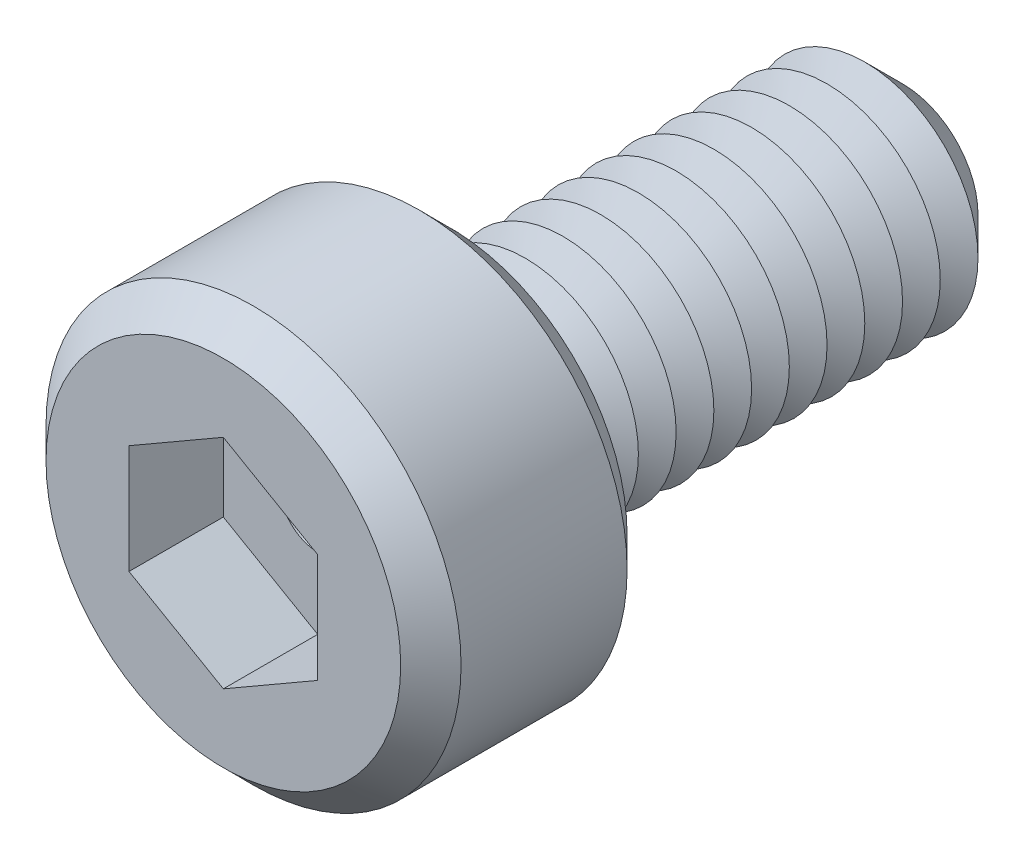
SolidWorks part; units mm, degrees
ref_plane "Front Plane" through (0, 0, 0) normal (0, 0, 1) x (1, 0, 0)
ref_plane "Top Plane" through (0, 0, 0) normal (0, 1, 0) x (1, 0, 0)
ref_plane "Right Plane" through (0, 0, 0) normal (1, 0, 0) x (0, 0, -1)
sketch "Sketch1" plane through (0, 0, 0) normal (0, 0, 1) x (1, 0, 0)
  circle A0 centre (0, 0) radius 2.75
  dimension "D1" = 5.5
extrude "Boss-Extrude1" add sketch "Sketch1" along normal blind 3
sketch "Sketch2" plane through (0, 0, 0) normal (0, 0, -1) x (-1, 0, 0)
  circle A0 centre (0, 0) radius 1.5
  dimension "D1" = 3
extrude "Boss-Extrude2" add sketch "Sketch2" along normal blind 6
chamfer "Chamfer1" distance 0.5 angle 45 1 edges at (-1.5, 0, -6)
sketch "Sketch3" plane through (0, 0, 0) normal (1, 0, 0) x (0, 0, -1)
  line L0 (-2.5121, 0) -> (4.5776, 0) construction
sketch "Sketch4" plane through (0, 0, 0) normal (1, 0, 0) x (0, 0, -1)
  line L0 (0, 1.5) -> (0.25, 1.067)
  line L1 (0.25, 1.067) -> (0.5, 1.5)
  line L2 (5.5, 1.5) -> (0, 1.5) construction
  line L3 (0.5, 1.5) -> (0, 1.5)
  dimension "D1" = 0.5
revolve "Cut-Revolve1" cut sketch "Sketch4" angle 360 about L0
pattern_linear "LPattern1" count 11 spacing 0.5 along (0, 0, -1) of "Cut-Revolve1"
sketch "Sketch5" plane through (0, 0, 3) normal (0, 0, 1) x (1, 0, 0)
  line L1 (0, 1.4434) -> (-1.25, 0.7217)
  line L2 (-1.25, 0.7217) -> (-1.25, -0.7217)
  line L3 (-1.25, -0.7217) -> (0, -1.4434)
  line L4 (0, -1.4434) -> (1.25, -0.7217)
  line L5 (1.25, -0.7217) -> (1.25, 0.7217)
  line L6 (1.25, 0.7217) -> (0, 1.4434)
  circle A0 centre (0, 0) radius 1.25 construction
  dimension "D1" = 2.5
extrude "Cut-Extrude1" cut sketch "Sketch5" against normal blind 1.25
sketch "Sketch6" plane through (0, 0, 1.75) normal (0, 0, 1) x (1, 0, 0)
  circle A0 centre (0, 0) radius 0.5
  dimension "D1" = 1
extrude "Cut-Extrude2" cut sketch "Sketch6" against normal up to surface (7.75 mm away)
chamfer "Chamfer2" distance 0.4 angle 45 2 edges at (2.75, 0, 0) (2.75, 0, 3)
